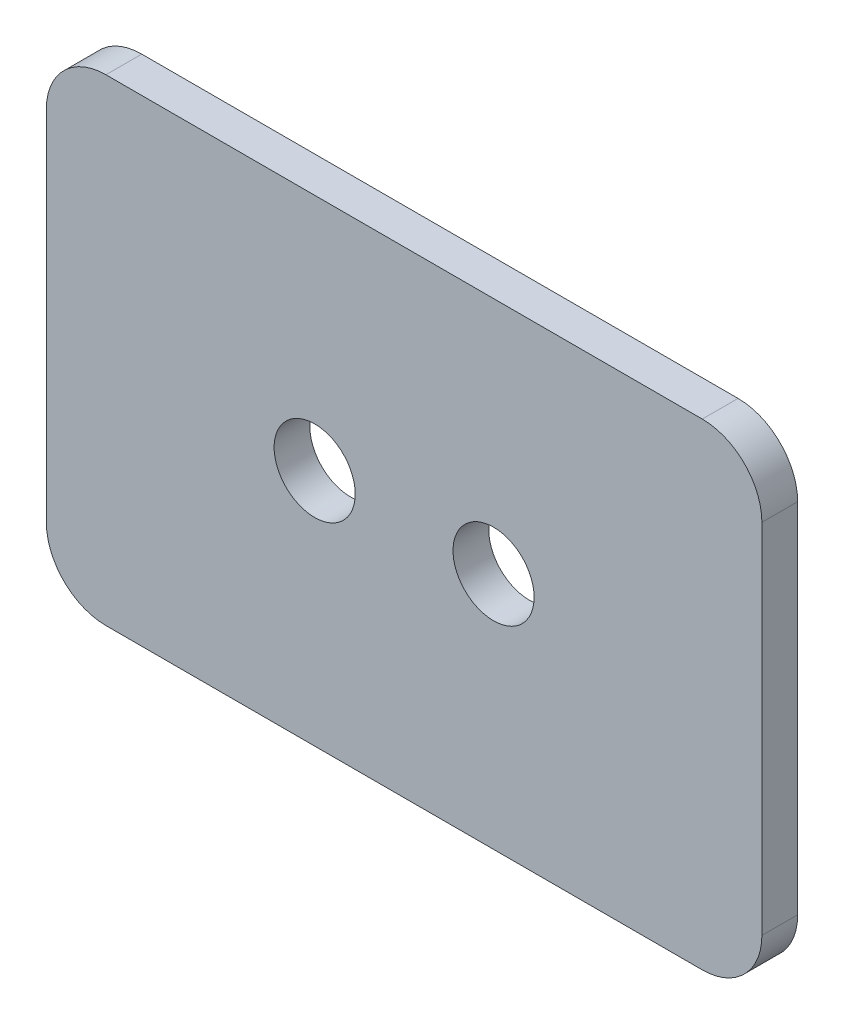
SolidWorks part; units mm, degrees
ref_plane "Plan de face" through (0, 0, 0) normal (0, 0, 1) x (1, 0, 0)
ref_plane "Plan de dessus" through (0, 0, 0) normal (0, 1, 0) x (1, 0, 0)
ref_plane "Plan de droite" through (0, 0, 0) normal (1, 0, 0) x (0, 0, -1)
sketch "Esquisse1" plane through (0, 0, 0) normal (0, 0, 1) x (1, 0, 0)
  line L1 (0, 0) -> (60, 0)
  line L2 (0, 0) -> (0, 40)
  line L3 (0, 40) -> (60, 40)
  line L4 (60, 0) -> (60, 40)
  dimension "D1" = 40
  dimension "D2" = 60
extrude "Extrusion1" add sketch "Esquisse1" along normal blind 3
sketch "Esquisse2" plane through (0, 0, 3) normal (0, 0, 1) x (1, 0, 0)
  line L0 (0, 20) -> (60, 20) construction
  line L1 (0, 40) -> (0, 0) construction
  line L2 (60, 0) -> (60, 40) construction
  circle A0 centre (22.5, 20) radius 3.4
  circle A1 centre (37.5, 20) radius 3.4
  dimension "D1" = 6.8
  dimension "D2" = 15
  dimension "D3" = 22.5
extrude "Extrusion2" cut sketch "Esquisse2" against normal blind 4
fillet "Congé1" radius 5 4 edges at (60, 40, 1.5) (60, 0, 1.5) (0, 0, 1.5) (0, 40, 1.5)
